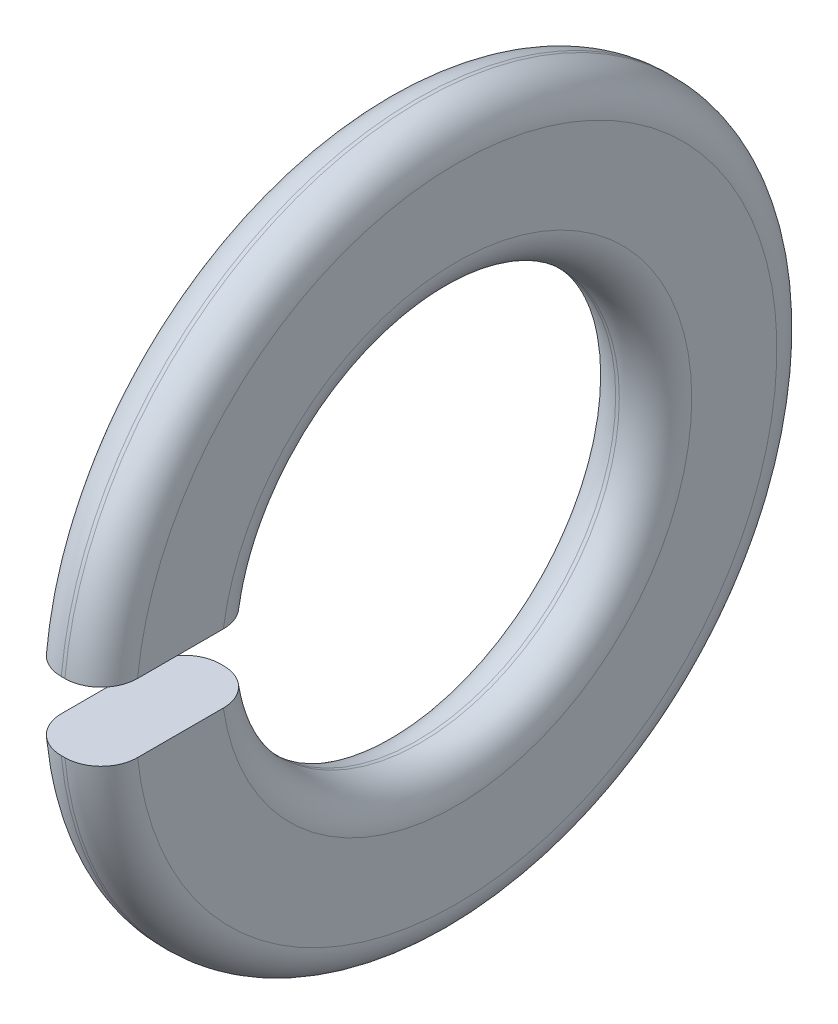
SolidWorks part; units mm, degrees
ref_plane "Plane1" through (0, 0, 0) normal (0, 0, 1) x (1, 0, 0)
ref_plane "Plane2" through (0, 0, 0) normal (0, 1, 0) x (1, 0, 0)
ref_plane "Plane3" through (0, 0, 0) normal (1, 0, 0) x (0, 0, -1)
sketch "Sketch1" plane through (0, 0, 0) normal (0, 0, 1) x (1, 0, 0)
  line L0 (-34.925, 0) -> (9.525, 0) construction
  line L1 (0, 6.5) -> (0, 8.85)
  line L2 (-1, 9.85) -> (-1.1, 9.85)
  line L3 (-2.1, 8.85) -> (-2.1, 6.5)
  line L4 (-1.1, 5.5) -> (-1, 5.5)
  arc A0 (-1.1, 5.5) -> (-2.1, 6.5) centre (-1.1, 6.5) cw
  arc A1 (0, 6.5) -> (-1, 5.5) centre (-1, 6.5) cw
  arc A2 (-1.1, 9.85) -> (-2.1, 8.85) centre (-1.1, 8.85) ccw
  arc A3 (0, 8.85) -> (-1, 9.85) centre (-1, 8.85) ccw
  point P8 (-2.1, 5.5)
  point P14 (-2.1, 9.85)
  point P17 (0, 9.85)
  dimension "Fillet_rad" = 1
  dimension "D1" = 1
  dimension "D2" = 1
  dimension "Thickness" = 2.1
  dimension "Inside_dia" = 11
  dimension "Outside_dia" = 19.7
revolve "Base-Revolve" add sketch "Sketch1" angle 360 about L0
sketch "Sketch2" plane through (0, 0, 0) normal (-1, 0, 0) x (0, -1, 0)
  line L0 (-0.945, 0) -> (0.945, 0)
  line L1 (0, 0) -> (0, 12.7) construction
  line L2 (0.945, 0) -> (0.945, 10.047)
  line L3 (0.945, 10.047) -> (-0.945, 10.047)
  line L4 (-0.945, 10.047) -> (-0.945, 0)
  dimension "D1" = 1.89
  dimension "D2" = 10.047
extrude "Gap" cut sketch "Sketch2" along normal through all
equation "\"D1@Sketch1\" = \"Fillet_rad@Sketch1\""
equation "\"D1@Sketch2\" = \"Thickness@Sketch1\" * 0.9"
equation "\"D2@Sketch2\" = \"Outside_dia@Sketch1\" * 0.51"
equation "\"D2@Sketch1\" = \"Fillet_rad@Sketch1\""
